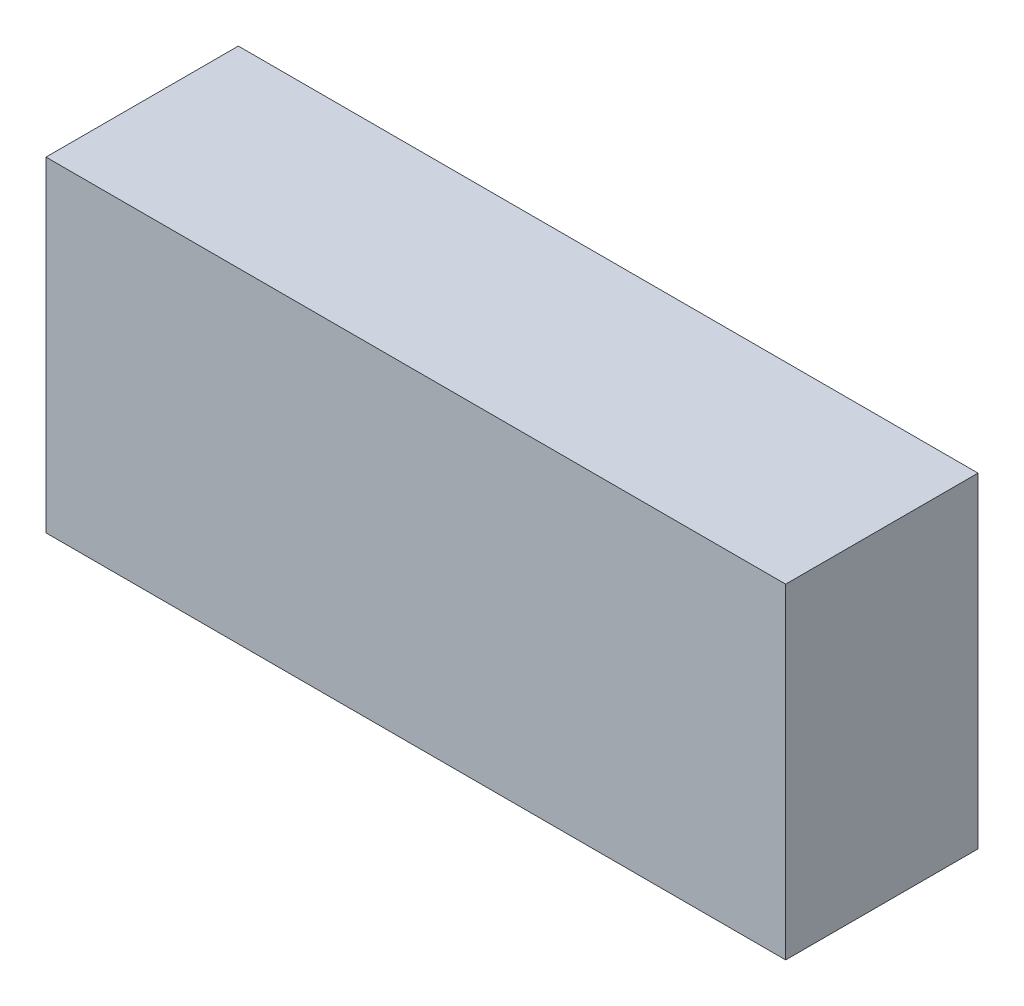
SolidWorks part; units mm, degrees
ref_plane "Front Plane" through (0, 0, 0) normal (0, 0, 1) x (1, 0, 0)
ref_plane "Top Plane" through (0, 0, 0) normal (0, 1, 0) x (1, 0, 0)
ref_plane "Right Plane" through (0, 0, 0) normal (1, 0, 0) x (0, 0, -1)
sketch "GENERAL" plane through (0, 0, 0) normal (0, 0, 1) x (1, 0, 0)
  line L8 (-1.25, -0.55) -> (1.25, -0.55)
  line L9 (1.25, -0.55) -> (1.25, 0.55)
  line L10 (1.25, 0.55) -> (-1.25, 0.55)
  line L11 (-1.25, 0.55) -> (-1.25, -0.55)
extrude "Boss-Extrude1" add sketch "GENERAL" along normal blind 0.65
